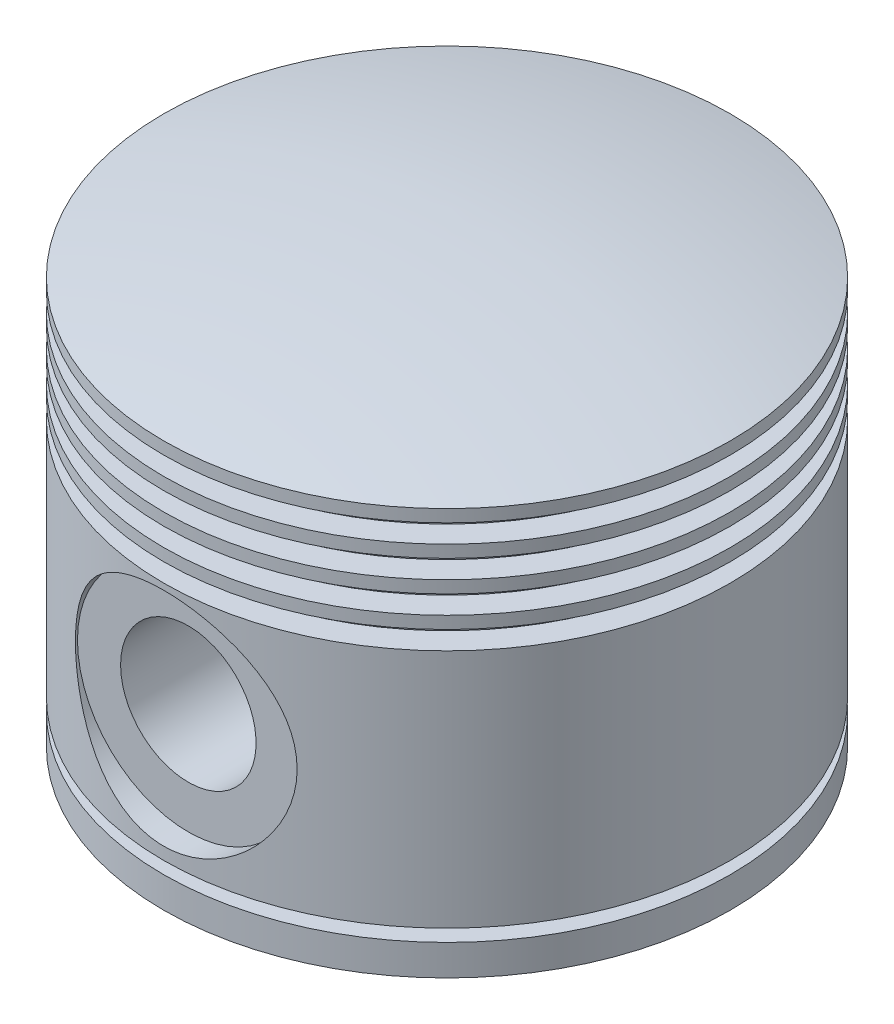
SolidWorks part; units mm, degrees
ref_plane "Front Plane" through (0, 0, 0) normal (0, 0, 1) x (1, 0, 0)
ref_plane "Top Plane" through (0, 0, 0) normal (0, 1, 0) x (1, 0, 0)
ref_plane "Right Plane" through (0, 0, 0) normal (1, 0, 0) x (0, 0, -1)
sketch "Sketch1" plane through (0, 0, 0) normal (0, 0, 1) x (1, 0, 0)
  line L0 (0, 0) -> (0, 80.5112) construction
  line L1 (46, 0) -> (46, 5)
  line L2 (46, 5) -> (42.5, 5)
  line L3 (42.5, 5) -> (42.5, 7)
  line L4 (42.5, 7) -> (46, 7)
  line L5 (0, 62) -> (0, 71.6833)
  line L6 (38.5, 12) -> (38.5, 42)
  line L9 (46, 7) -> (46, 46)
  line L10 (46, 46) -> (42, 46)
  line L11 (42, 46) -> (42, 49)
  line L12 (42, 49) -> (46, 49)
  line L13 (46, 49) -> (46, 51)
  line L14 (46, 51) -> (42, 51)
  line L15 (42, 51) -> (42, 54)
  line L16 (42, 54) -> (46, 54)
  line L17 (46, 54) -> (46, 56)
  line L18 (46, 56) -> (42, 56)
  line L19 (42, 56) -> (42, 59)
  line L20 (42, 59) -> (46, 59)
  line L21 (46, 59) -> (46, 61)
  line L22 (46, 0) -> (37, 0)
  line L23 (37, 0) -> (37, 12)
  line L24 (37, 12) -> (38.5, 12)
  line L26 (38.5, 42) -> (37, 42)
  line L27 (37, 42) -> (37, 62)
  line L28 (37, 62) -> (0, 62)
  line L29 (46, 61) -> (42, 61)
  line L30 (42, 61) -> (42, 64)
  line L31 (42, 64) -> (46, 64)
  line L32 (46, 64) -> (46, 66)
  arc A0 (46, 66) -> (0, 71.6833) centre (0, -117.3167) ccw
  dimension "D8" = 189
  dimension "D2" = 85
  dimension "D3" = 3
  dimension "D4" = 74
  dimension "D5" = 77
  dimension "D6" = 2
  dimension "D7" = 2
  dimension "D9" = 39
  dimension "D10" = 7
  dimension "D11" = 12
  dimension "D12" = 30
  dimension "D13" = 62
  dimension "D14" = 92
  dimension "D15" = 4
revolve "Revolve1" add sketch "Sketch1" angle 360 about L0
ref_plane "Plane1" through (0, 0, -25) normal (0, 0, 1) x (1, 0, 0)
sketch "Sketch4" plane through (0, 0, -25) normal (0, 0, 1) x (1, 0, 0)
  circle A0 centre (0, 27) radius 19
  dimension "D1" = 38
  dimension "D2" = 27
extrude "Extrude1" add sketch "Sketch4" against normal up to next
sketch "Sketch6" plane through (0, 0, 0) normal (-1, 0, 0) x (0, 0, 1)
  line L0 (-59.607, 27) -> (1.8772, 27) construction
  line L1 (-46, 27) -> (-46, 45)
  line L2 (-46, 45) -> (-42, 45)
  line L3 (-42, 45) -> (-42, 38)
  line L4 (-42, 38) -> (-25, 38)
  line L5 (-25, 8) -> (-25, 46) construction
  line L6 (-25, 38) -> (-25, 27)
  line L7 (-25, 27) -> (-46, 27)
  line L8 (-46, 46) -> (-46, 7) construction
  line L9 (-42, 49) -> (-42, 46) construction
  dimension "D1" = 36
  dimension "D2" = 22
revolve "Cut-Revolve1" cut sketch "Sketch6" angle 360 about L0
mirror "Mirror1" about plane through (0, 0, 0) normal (0, 0, 1) of "Cut-Revolve1", "Extrude1"
